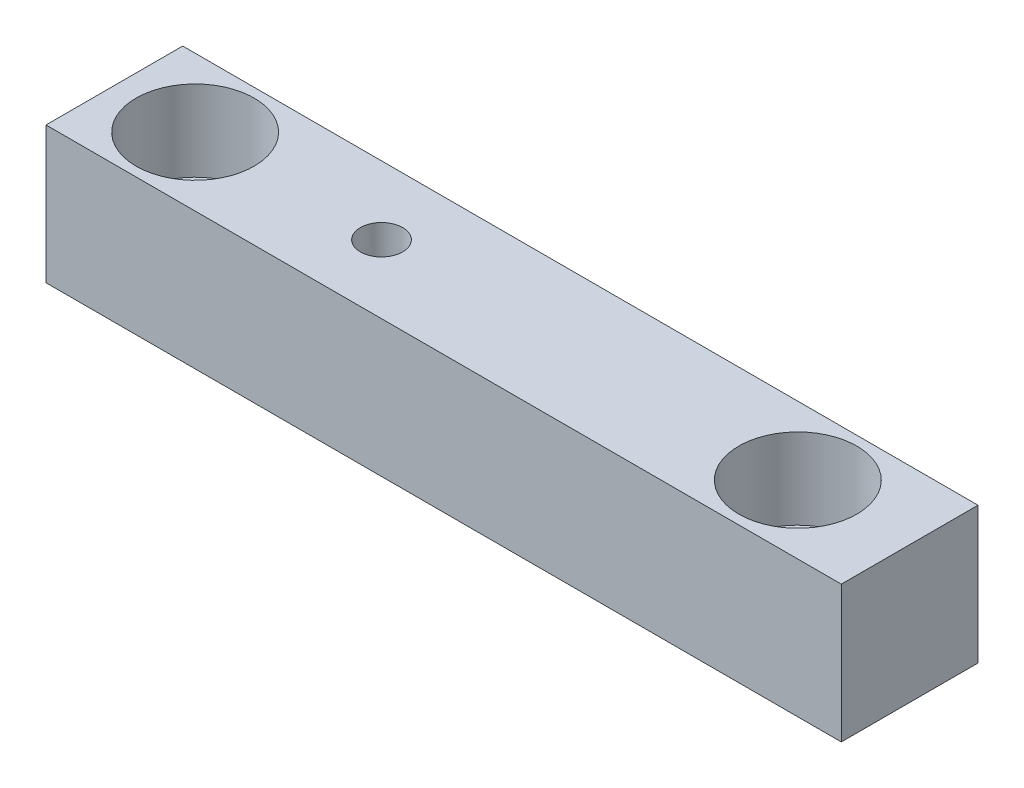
SolidWorks part; units mm, degrees
ref_plane "Plan de face" through (0, 0, 0) normal (0, 0, 1) x (1, 0, 0)
ref_plane "Plan de dessus" through (0, 0, 0) normal (0, 1, 0) x (1, 0, 0)
ref_plane "Plan de droite" through (0, 0, 0) normal (1, 0, 0) x (0, 0, -1)
sketch "Esquisse1" plane through (0, 0, 0) normal (0, 0, 1) x (1, 0, 0)
  line L1 (0, 0) -> (128, 0)
  line L2 (0, 0) -> (0, 22)
  line L3 (0, 22) -> (128, 22)
  line L4 (128, 0) -> (128, 22)
  dimension "D1" = 128
  dimension "D2" = 22
extrude "Boss.-Extru.1" add sketch "Esquisse1" along normal blind 22
sketch "Esquisse6" plane through (0, 22, 0) normal (0, 1, 0) x (1, 0, 0)
  line L0 (128, 0) -> (0, 0) construction
  line L1 (0, -22) -> (0, 0) construction
  circle A0 centre (13, -11) radius 6.25
  circle A1 centre (110, -11) radius 6.25
  dimension "D1" = 12.5
  dimension "D2" = 12.5
  dimension "D3" = 11
  dimension "D4" = 11
  dimension "D5" = 97
  dimension "D6" = 13
extrude "Enlèv. mat.-Extru.1" cut sketch "Esquisse6" against normal through all
sketch "Esquisse8" plane through (0, 22, 0) normal (0, 1, 0) x (1, 0, 0)
  circle A0 centre (13, -11) radius 9.5
  circle A1 centre (110, -11) radius 9.5
  circle A2 centre (110, -11) radius 6.25 construction
  circle A3 centre (13, -11) radius 6.25 construction
  dimension "D1" = 19
  dimension "D2" = 19
extrude "Enlèv. mat.-Extru.2" cut sketch "Esquisse8" against normal blind 13
hole_wizard "Trou taraudé M81" positions "Esquisse10" profile "Esquisse9" tap size "M8" standard "ISO"
sketch "Esquisse10" plane through (0, 22, 0) normal (0, 1, 0) x (1, 0, 0)
  line L0 (128, 0) -> (0, 0) construction
  circle A0 centre (13, -11) radius 6.25 construction
  point P0 (43, -11)
  dimension "D1" = 30
  dimension "D2" = 11
sketch "Esquisse9" plane through (43, 22, 11) normal (1, 0, 0) x (0, 0, 1)
  line L0 (0, 0) -> (0, 22)
  line L1 (0, 22) -> (3.4, 22)
  line L2 (3.4, 22) -> (3.4, 0)
  line L5 (3.4, 0) -> (0, 0)
  line L11 (0, -6.35) -> (0, 107.95) construction
  dimension "Diamètre du trou pour taraudage jusqu'au prochain" = 6.8
  dimension "Profondeur du trou pour taraudage jusqu'au prochain" = 22
